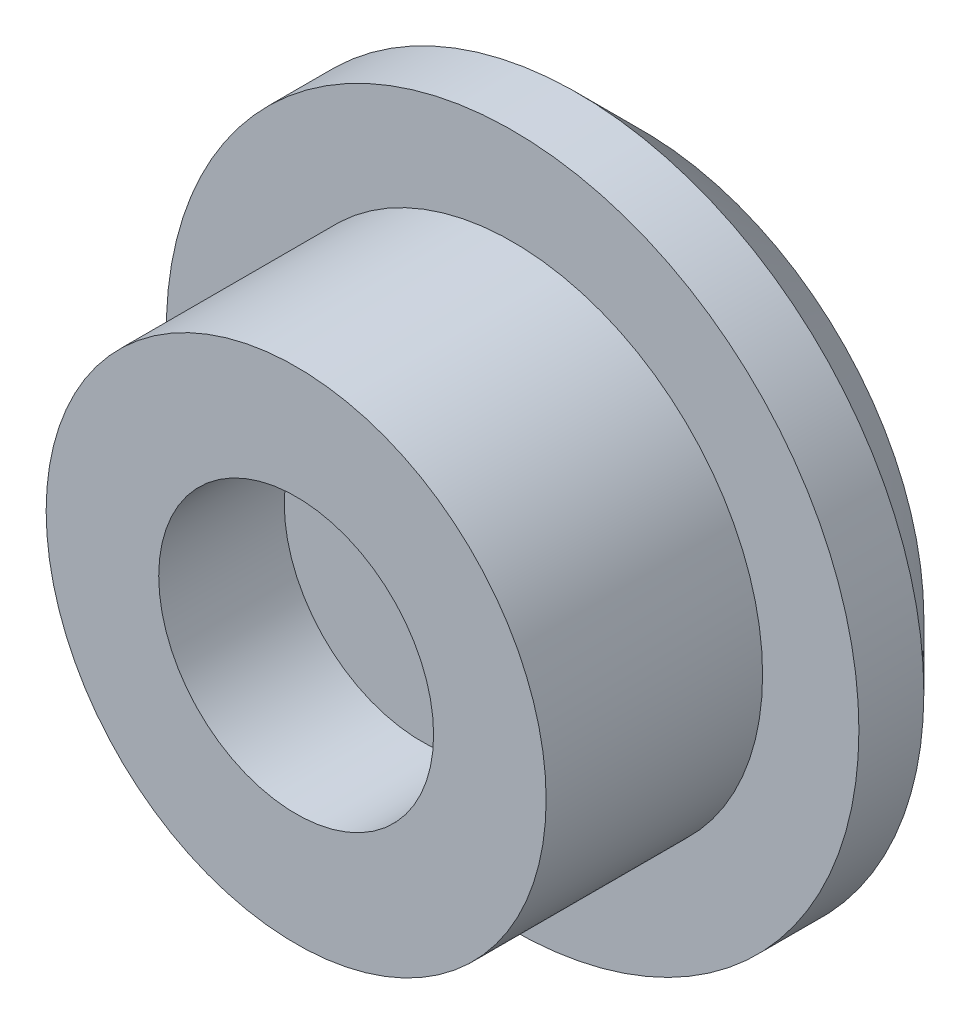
SolidWorks part; units mm, degrees
ref_plane "Front Plane" through (0, 0, 0) normal (0, 0, 1) x (1, 0, 0)
ref_plane "Top Plane" through (0, 0, 0) normal (0, 1, 0) x (1, 0, 0)
ref_plane "Right Plane" through (0, 0, 0) normal (1, 0, 0) x (0, 0, -1)
sketch "Sketch1" plane through (0, 0, 0) normal (0, 0, 1) x (1, 0, 0)
  circle A0 centre (0, 0) radius 5.775
  dimension "D1" = 11.55
extrude "Boss-Extrude1" add sketch "Sketch1" along normal blind 5
sketch "Sketch2" plane through (0, 0, 0) normal (0, 0, 1) x (1, 0, 0)
  circle A0 centre (0, 0) radius 8
  dimension "D1" = 16
extrude "Boss-Extrude2" add sketch "Sketch2" against normal blind 3
sketch "Sketch3" plane through (0, 0, 5) normal (0, 0, 1) x (1, 0, 0)
  circle A0 centre (0, 0) radius 3.175
  dimension "D1" = 6.35
extrude "Cut-Extrude1" cut sketch "Sketch3" against normal blind 2.9
chamfer "Chamfer1" distance 1.5 angle 45 1 edges at (8, 0, -3)
